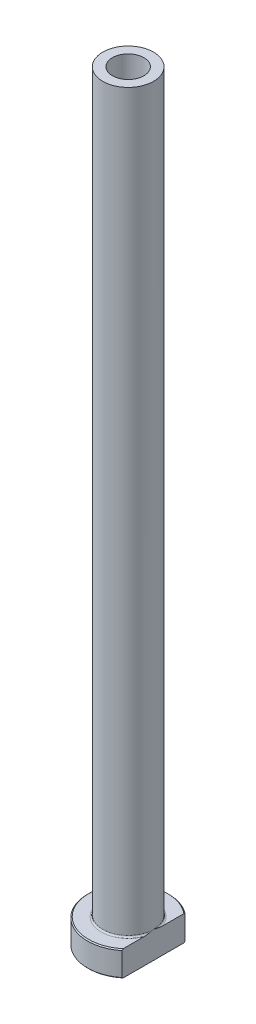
SolidWorks part; units mm, degrees
ref_plane "Front Plane" through (0, 0, 0) normal (0, 0, 1) x (1, 0, 0)
ref_plane "Top Plane" through (0, 0, 0) normal (0, 1, 0) x (1, 0, 0)
ref_plane "Right Plane" through (0, 0, 0) normal (1, 0, 0) x (0, 0, -1)
sketch "Sketch1" plane through (0, 0, 0) normal (0, 0, 1) x (1, 0, 0)
  line L0 (-3.1, 150) -> (-5, 150)
  line L1 (-5, 150) -> (-5, 5)
  line L2 (-5, 5) -> (-8, 5)
  line L3 (-8, 5) -> (-8, 0)
  line L4 (7.15, 0) -> (-7.15, 0) construction
  line L5 (-8, 0) -> (-3.35, 0)
  line L6 (-3.1, 105) -> (-3.1, 150)
  line L7 (0, 92.1877) -> (0, -15.5353) construction
  line L8 (0, -8.8) -> (0, 8.8) construction
  line L9 (-3.1, 105) -> (-3.35, 93)
  line L10 (-3.35, 93) -> (-3.35, 0)
  dimension "D1" = 0.25
  dimension "ID" = 6.2
  dimension "OD" = 10
  dimension "L" = 150
  dimension "H" = 16
  dimension "T" = 5
  dimension "N" = 45
  dimension "D2" = 12
  dimension "L-N" = 105
revolve "Revolve1" add sketch "Sketch1" angle 360 about L7
fillet "Fillet1" radius 0.3 1 edges at (0, 5, 5)
chamfer "Chamfer1" distance 0.2 angle 45 2 edges at (0, 5, 8) (0, 0, 8)
sketch "Sketch2" plane through (0, 0, 0) normal (0, -1, 0) x (1, 0, 0)
  line L0 (5, 6.245) -> (5, -6.245)
  circle A0 centre (0, 0) radius 8 construction
  arc A1 (5, 6.245) -> (5, -6.245) centre (0, 0) cw
  circle A2 centre (0, 0) radius 5 construction
extrude "Cut-Extrude1" cut sketch "Sketch2" against normal through all
chamfer "Chamfer2" distance 0.5 angle 45 1 edges at (0, 0, 3.35)
